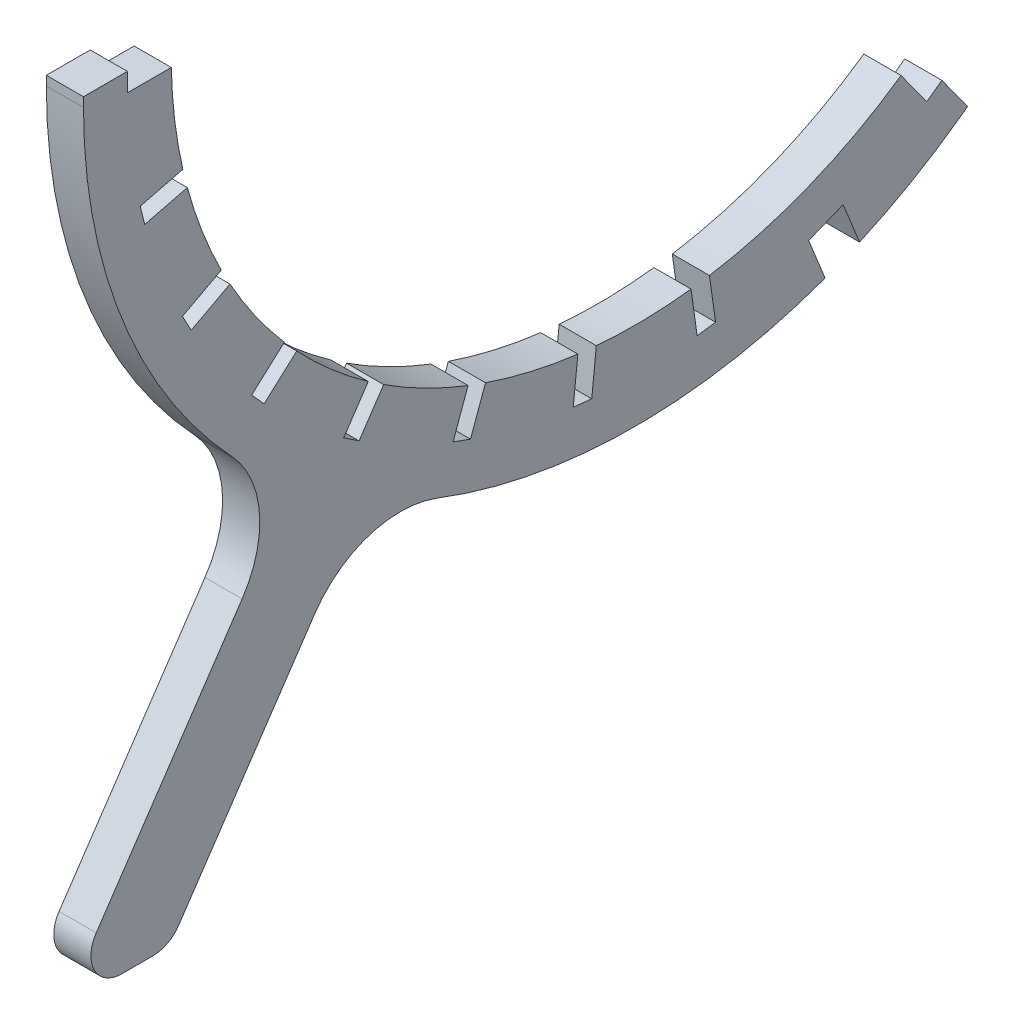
SolidWorks part; units mm, degrees
ref_plane "Спереди" through (0, 0, 0) normal (0, 0, 1) x (1, 0, 0)
ref_plane "Сверху" through (0, 0, 0) normal (0, 1, 0) x (1, 0, 0)
ref_plane "Справа" through (0, 0, 0) normal (1, 0, 0) x (0, 0, -1)
sketch "Эскиз1" plane through (0, 0, 0) normal (1, 0, 0) x (0, 0, -1)
  line L0 (296.7654, -393.1508) -> (321.7463, -427.534)
  line L1 (0, 0) -> (200.4145, -496.0434) construction
  line L2 (0, 0) -> (314.4651, -432.8241) construction
  line L3 (183.6118, -502.5054) -> (167.691, -463.1001)
  line L4 (62.6279, -445.6206) -> (74.4576, -529.7934) construction
  line L5 (0, 0) -> (-55.9227, -532.0692) construction
  line L6 (0, 0) -> (-182.9808, -502.7356) construction
  line L7 (0, 0) -> (-299.1682, -443.5351) construction
  line L8 (0, 0) -> (-397.5825, -357.9849) construction
  line L9 (0, 0) -> (-472.377, -251.1673) construction
  line L10 (0, 0) -> (-519.1082, -129.4282) construction
  line L11 (0, 0) -> (-535, 0) construction
  line L12 (-299.1682, -443.5351) -> (-502.9275, -745.6206) construction
  line L13 (-535, 0) -> (-535, -745.6206) construction
  line L14 (-554.1917, -745.6206) -> (-502.9275, -745.6206) construction
  line L15 (-381.2651, -489.2463) -> (-522.6411, -698.8448)
  line L16 (-310.7969, -536.7777) -> (-442.7434, -732.3964)
  line L17 (-451.6632, -745.6206) -> (707.3888, -745.6206) construction
  line L18 (-497.7699, -745.6206) -> (-467.6145, -745.6206)
  line L19 (-449.91, -9) -> (-492.5, -9)
  line L20 (-334.4023, -419.7694) -> (-641.6265, -875.248) construction
  line L21 (-263.9341, -467.3008) -> (-571.1583, -922.7794) construction
  line L22 (-299.1682, -443.5351) -> (-606.3924, -899.0137) construction
  line L23 (-500, -9) -> (-382.4746, -9) construction
  line L24 (-492.5, -9) -> (-492.5, 9)
  line L25 (-382.4746, 9) -> (-500, 9) construction
  line L26 (321.7463, -427.534) -> (314.4651, -432.8241)
  line L27 (-492.5, 9) -> (-535, 9)
  line L28 (-535, 9) -> (-535, 0)
  line L29 (-480.0479, -110.4139) -> (-438.723, -100.1104)
  line L30 (-475.6933, -127.8792) -> (-480.0479, -110.4139)
  line L31 (-434.3684, -117.5757) -> (-475.6933, -127.8792)
  line L32 (-439.0769, -223.2682) -> (-401.4722, -203.2734)
  line L33 (-430.6264, -239.1613) -> (-439.0769, -223.2682)
  line L34 (-393.0217, -219.1665) -> (-430.6264, -239.1613)
  line L35 (-372.021, -322.8585) -> (-340.3705, -294.3602)
  line L36 (-359.9767, -336.2351) -> (-372.021, -322.8585)
  line L37 (-328.3261, -307.7368) -> (-359.9767, -336.2351)
  line L38 (-282.8638, -403.2683) -> (-259.0478, -367.9596)
  line L39 (-267.9412, -413.3337) -> (-282.8638, -403.2683)
  line L40 (-244.1251, -378.025) -> (-267.9412, -413.3337)
  line L41 (-176.9022, -459.7204) -> (-162.3355, -419.6989)
  line L42 (-159.9877, -465.8768) -> (-176.9022, -459.7204)
  line L43 (-145.421, -425.8553) -> (-159.9877, -465.8768)
  line L44 (-60.431, -488.8613) -> (-55.9791, -446.5046)
  line L45 (-42.5296, -490.7428) -> (-60.431, -488.8613)
  line L46 (-38.0777, -448.3861) -> (-42.5296, -490.7428)
  line L47 (59.6303, -488.9596) -> (53.703, -446.7841)
  line L48 (77.4552, -486.4545) -> (59.6303, -488.9596)
  line L49 (71.5278, -444.2789) -> (77.4552, -486.4545)
  line L50 (142.5098, -400.7745) -> (184.4637, -504.6141) construction
  line L51 (192.8384, -453.2666) -> (176.1491, -460.0095)
  line L52 (176.8839, -413.7778) -> (192.8384, -453.2666)
  line L53 (282.2031, -403.7309) -> (257.1693, -369.2749)
  line L54 (296.7654, -393.1508) -> (282.2031, -403.7309)
  line L55 (167.691, -463.1001) -> (201.0696, -449.6143)
  line L56 (271.7316, -358.6948) -> (296.7654, -393.1508)
  line L57 (217.8423, -491.1283) -> (175.8884, -387.2886) construction
  line L58 (201.0696, -449.6143) -> (216.9904, -489.0196)
  arc A0 (-449.91, -9) -> (-438.723, -100.1104) centre (0, 0) ccw
  arc A1 (-535, 0) -> (-391.0714, -365.0865) centre (0, 0) ccw
  arc A2 (-310.7969, -536.7777) -> (-192.0044, -499.3589) centre (-227.8931, -592.697) cw
  arc A3 (-381.2651, -489.2463) -> (-391.0714, -365.0865) centre (-464.1688, -433.327) ccw
  arc A4 (-192.0044, -499.3589) -> (183.6118, -502.5054) centre (0, 0) ccw
  arc A5 (-522.6411, -698.8448) -> (-497.7699, -745.6206) centre (-497.7699, -715.6206) ccw
  arc A6 (-442.7434, -732.3964) -> (-467.6145, -745.6206) centre (-467.6145, -715.6206) cw
  arc A7 (-393.0217, -219.1665) -> (-340.3705, -294.3602) centre (0, 0) ccw
  arc A8 (-328.3261, -307.7368) -> (-259.0478, -367.9596) centre (0, 0) ccw
  arc A9 (71.5278, -444.2789) -> (257.1693, -369.2749) centre (0, 0) ccw
  arc A10 (-38.0777, -448.3861) -> (53.703, -446.7841) centre (0, 0) ccw
  arc A11 (-145.421, -425.8553) -> (-55.9791, -446.5046) centre (0, 0) ccw
  arc A12 (-244.1251, -378.025) -> (-162.3355, -419.6989) centre (0, 0) ccw
  arc A13 (-434.3684, -117.5757) -> (-401.4722, -203.2734) centre (0, 0) ccw
  arc A14 (216.9904, -489.0196) -> (314.4651, -432.8241) centre (0, 0) ccw
  point P18 (0, 0)
  point P88 (0, 0)
  dimension "D1" = 900
  dimension "D2" = 1070
  dimension "D5" = 300
  dimension "D8" = 100
  dimension "D9" = 100
  dimension "D10" = 30
  dimension "D3" = 10
  dimension "D4" = 10
  dimension "D11" = 42.5
  dimension "D6" = 42.5
  dimension "D7" = 42.5
extrude "Бобышка-Вытянуть1" add sketch "Эскиз1" along normal mid plane 36
